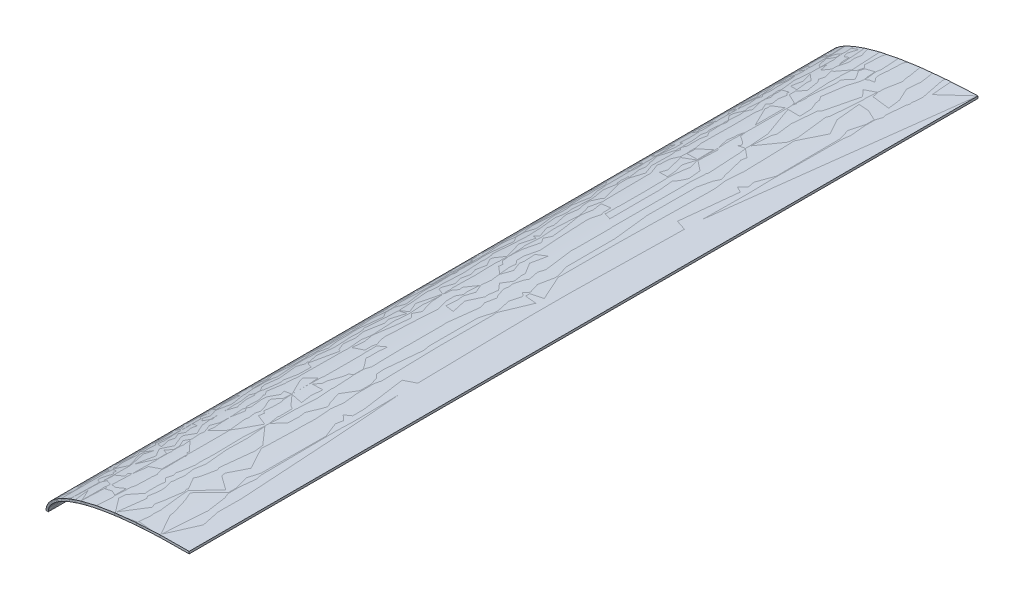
SolidWorks part; units mm, degrees
ref_plane "Спереди" through (0, 0, 0) normal (0, 0, 1) x (1, 0, 0)
ref_plane "Сверху" through (0, 0, 0) normal (0, 1, 0) x (1, 0, 0)
ref_plane "Справа" through (0, 0, 0) normal (1, 0, 0) x (0, 0, -1)
sketch "Эскиз1" plane through (0, 0, 0) normal (0, 0, 1) x (1, 0, 0)
  line L0 (170, 0) -> (171.501, 0)
  line L1 (264.974, 22.4812) -> (264.974, 23.9813)
  spline S0 degree 3 poles (61.1195, -2976.7929) (172.4772, -6.5238) (171.2694, -2.7471) (171.5646, 0.9656) (171.7338, 1.8537) (172.0316, 2.7212) (172.5977, 3.8782) (173.5513, 5.243) (175.4595, 7.2214) (178.3401, 9.3288) (183.4541, 12.0929) (190.3658, 14.7211) (198.974, 17.0573) (207.7529, 18.817) (219.5832, 20.5811) (234.5096, 21.9232) (248.1679, 22.4127) (256.8351, 22.5016) (259.9999, 22.5076) (261.9999, 22.5025) (263.9999, 22.4915) (266.8403, 22.4636) (275.1868, 22.3276) (288.5392, 21.8551) (306.5432, 20.7726) (324.5276, 19.3285) (348.4777, 17.0076) (378.3587, 13.4888) (1711.862, -173.1439) (2808.2077, -1872.5083) (11.8323, -1172.5267) knots -0.03628 -0.03628 -0.03628 -0.03628 0.000049 0.00371 0.007617 0.011524 0.015431 0.023245 0.031059 0.046687 0.062315 0.093571 0.124827 0.156083 0.18734 0.249852 0.312364 0.329697 0.340107 0.345312 0.350517 0.360926 0.374877 0.437389 0.499901 0.562414 0.624926 0.749951 0.874975 14.611833 14.611833 14.611833 14.611833 only from (171.501, 0) to (449.7464, 2.6199)
  spline S1 degree 3 poles (171.501, 0) (171.5011, 0.0042) (171.5134, 0.3214) (171.5646, 0.9656) (171.7338, 1.8537) (172.0316, 2.7212) (172.5977, 3.8782) (173.5513, 5.243) (175.4595, 7.2214) (178.3401, 9.3288) (183.4541, 12.0929) (190.3658, 14.7211) (198.974, 17.0573) (207.7529, 18.817) (219.5832, 20.5811) (234.5096, 21.9232) (248.1679, 22.4127) (256.8351, 22.5016) (259.9999, 22.5076) (261.9999, 22.5025) (263.4912, 22.4943) (264.4826, 22.486) (264.974, 22.4812) knots 0 0 0 0 0.000049 0.00371 0.007617 0.011524 0.015431 0.023245 0.031059 0.046687 0.062315 0.093571 0.124827 0.156083 0.18734 0.249852 0.312364 0.329697 0.340107 0.345312 0.350517 0.355631 0.355631 0.355631 0.355631
  spline S2 degree 3 poles (-2302.7544, 1694.3597) (331.4813, -103.8418) (157.2778, -25.1311) (171.425, 5.0086) (173.5722, 7.5695) (176.9104, 10.2236) (181.5591, 12.8342) (187.7583, 15.3842) (195.4784, 17.7444) (204.9325, 19.8648) (216.1099, 21.6364) (229.3815, 23.017) (244.0576, 23.8336) (261.5176, 24.1166) (281.4965, 23.7064) (304.4633, 22.4679) (330.6078, 20.3423) (360.4215, 17.1924) (1916.4353, -181.612) (3170.3629, -2486.1517) (-212.0028, 817.5641) knots -0.311965 -0.311965 -0.311965 -0.311965 0.007934 0.017461 0.028977 0.04242 0.061544 0.084162 0.111888 0.145242 0.184646 0.229276 0.283662 0.337135 0.410456 0.490991 0.575782 0.682633 0.802069 16.852931 16.852931 16.852931 16.852931 only from (170, 0) to (450, 4.0983)
  spline S3 degree 3 poles (170, 0) (170.0259, 0.7641) (170.2226, 2.447) (171.425, 5.0086) (173.5722, 7.5695) (176.9104, 10.2236) (181.5591, 12.8342) (187.7583, 15.3842) (195.4784, 17.7444) (204.9325, 19.8648) (216.1099, 21.6364) (229.3815, 23.017) (244.0576, 23.8336) (256.2416, 24.0311) (263.1843, 23.9987) (264.974, 23.9813) knots 0 0 0 0 0.007934 0.017461 0.028977 0.04242 0.061544 0.084162 0.111888 0.145242 0.184646 0.229276 0.283662 0.337135 0.355708 0.355708 0.355708 0.355708
extrude "Бобышка-Вытянуть2" add sketch "Эскиз1" against normal up to surface (519.2857 mm away)
ref_plane "Плоскость1" through (0, 0, -523.356) normal (0, 0, 1) x (1, 0, 0)
sketch "Эскиз2" plane through (0, 0, -523.356) normal (0, 0, 1) x (1, 0, 0)
  spline S0 degree 3 poles (840.3741, 1864.255) (837.4576, -226.847) (543.5662, 28.6868) (244.0576, 23.8336) (229.3815, 23.017) (216.1099, 21.6364) (204.9325, 19.8648) (195.4784, 17.7444) (187.7583, 15.3842) (181.5591, 12.8342) (176.9104, 10.2236) (173.5722, 7.5695) (171.425, 5.0086) (158.8514, -21.7787) (293.8634, -86.3771) (-1479.149, 1130.6866) knots -2.337236 -2.337236 -2.337236 -2.337236 0.662865 0.716338 0.770724 0.815354 0.854758 0.888112 0.915838 0.938456 0.95758 0.971023 0.982539 0.992066 1.274042 1.274042 1.274042 1.274042 only from (264.974, 23.9813) to (170, 0) construction
  spline S1 degree 3 poles (264.974, 23.9813) (263.1843, 23.9987) (256.2416, 24.0311) (244.0576, 23.8336) (229.3815, 23.017) (216.1099, 21.6364) (204.9325, 19.8648) (195.4784, 17.7444) (187.7583, 15.3842) (181.5591, 12.8342) (176.9104, 10.2236) (173.5722, 7.5695) (171.425, 5.0086) (170.2226, 2.447) (170.0259, 0.7641) (170, 0) knots 0.644292 0.644292 0.644292 0.644292 0.662865 0.716338 0.770724 0.815354 0.854758 0.888112 0.915838 0.938456 0.95758 0.971023 0.982539 0.992066 1 1 1 1
sketch "Эскиз3" plane through (0, 0, 0) normal (0, 0, 1) x (1, 0, 0)
  line L2 (264.974, 22.4812) -> (264.974, 23.9813)
  line L3 (170, 0) -> (171.501, 0)
  spline S2 degree 3 poles (134.991, -999.1006) (171.92, -4.4554) (171.3441, -1.8073) (171.5646, 0.9656) (171.7338, 1.8537) (172.0316, 2.7212) (172.5977, 3.8782) (173.5513, 5.243) (175.4595, 7.2214) (178.3401, 9.3288) (183.4541, 12.0929) (190.3658, 14.7211) (198.974, 17.0573) (207.7529, 18.817) (219.5832, 20.5811) (234.5096, 21.9232) (248.1679, 22.4127) (256.8351, 22.5016) (259.9999, 22.5076) (261.9999, 22.5025) (490.7863, 21.2451) (720.5495, -129.6993) (993.3265, 707.6818) knots -0.025168 -0.025168 -0.025168 -0.025168 0.000049 0.00371 0.007617 0.011524 0.015431 0.023245 0.031059 0.046687 0.062315 0.093571 0.124827 0.156083 0.18734 0.249852 0.312364 0.329697 0.340107 0.345312 0.350517 2.721644 2.721644 2.721644 2.721644 only from (171.501, 0) to (264.974, 22.4812)
  spline S3 degree 3 poles (824.6899, 2864.1305) (916.6972, -300.4821) (583.2402, 29.3297) (244.0576, 23.8336) (229.3815, 23.017) (216.1099, 21.6364) (204.9325, 19.8648) (195.4784, 17.7444) (187.7583, 15.3842) (181.5591, 12.8342) (176.9104, 10.2236) (173.5722, 7.5695) (171.425, 5.0086) (157.2752, -25.1366) (331.5478, -103.8719) (-2304.3091, 1695.4209) knots -2.748928 -2.748928 -2.748928 -2.748928 0.662865 0.716338 0.770724 0.815354 0.854758 0.888112 0.915838 0.938456 0.95758 0.971023 0.982539 0.992066 1.312028 1.312028 1.312028 1.312028 only from (264.974, 23.9813) to (170, 0)
  spline S5 degree 3 poles (264.974, 23.9813) (263.1843, 23.9987) (256.2416, 24.0311) (244.0576, 23.8336) (229.3815, 23.017) (216.1099, 21.6364) (204.9325, 19.8648) (195.4784, 17.7444) (187.7583, 15.3842) (181.5591, 12.8342) (176.9104, 10.2236) (173.5722, 7.5695) (171.425, 5.0086) (170.2226, 2.447) (170.0259, 0.7641) (170, 0) knots 0.644292 0.644292 0.644292 0.644292 0.662865 0.716338 0.770724 0.815354 0.854758 0.888112 0.915838 0.938456 0.95758 0.971023 0.982539 0.992066 1 1 1 1
  dimension "D1" = 0
sheet metal parameters "Листовой металл1" thickness 1.5 parameters "D1"=0.7366
lofted bend "Элемент по сечениям сгиба 1" thickness 1.5 parameters "D1"=0
other "Свободный изгиб1" parameters "D1"=1000, "D4"=57.296, "D5"=1
ref_plane "Плоскость2" through (0, -1, 0) normal (0, 1, 0) x (1, 0, 0)
sketch "Эскиз7" plane through (0, -1, 0) normal (0, 1, 0) x (1, 0, 0)
  line L0 (264.974, 523.356) -> (170, 519.2857)
  line L1 (170, 519.2857) -> (170, 523.356)
  line L2 (170, 523.356) -> (264.974, 523.356)
extrude "Вырез-Вытянуть2" cut sketch "Эскиз7" along normal blind 26
flat pattern "Развертка1"
sketch "Сгиб-Линии1" plane through (0.2576, 26.5501, 0) normal (0.0097, 1, 0) x (1, -0.0097, 0)
  line L0 (264.7288, 0) -> (264.7288, 523.3557) construction
  line L1 (163.0589, 0) -> (163.0589, 519.3178) construction
sketch3d "Граничная рамка1" [suppressed]
  line L0 (-101.6699, -261.678, 0) -> (-101.6699, 261.6777, 0) construction
  line L1 (0, -261.678, 0) -> (0, 261.6777, 0) construction
  line L2 (-101.6699, -261.678, 0) -> (0, -261.678, 0) construction
  line L3 (-101.6699, 261.6777, 0) -> (0, 261.6777, 0) construction
other "Плоское состояние-<Свободный изгиб1>1"
